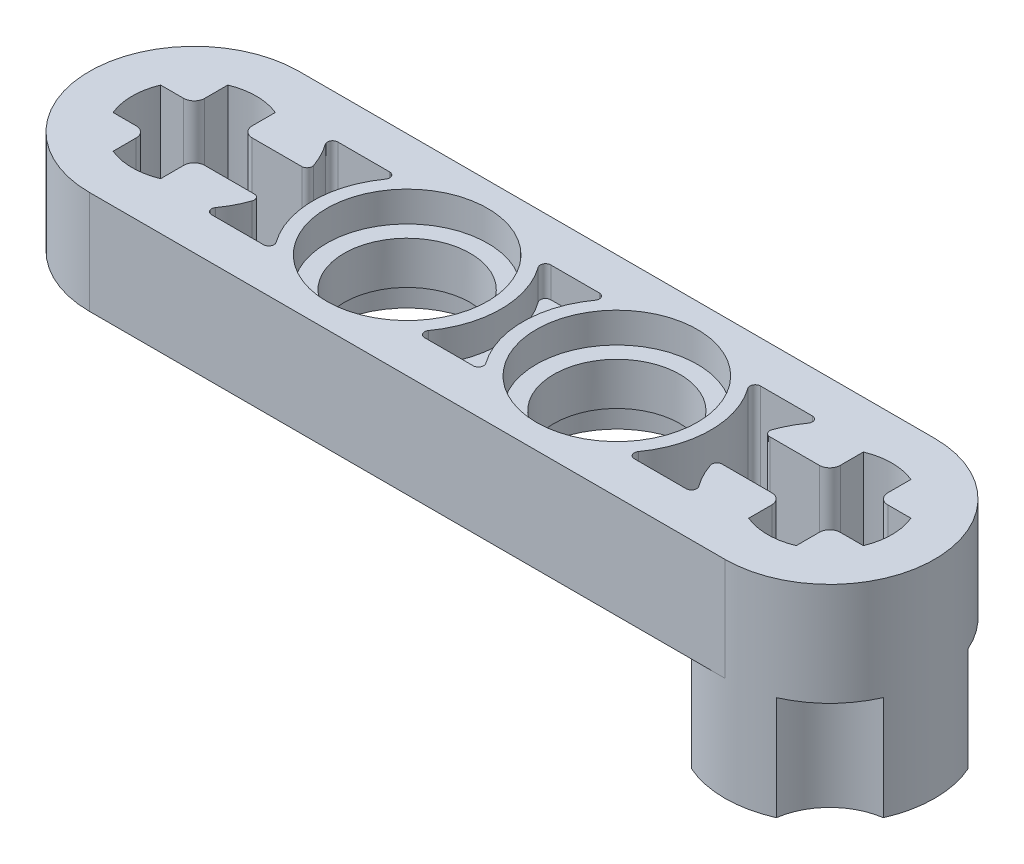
SolidWorks part; units mm, degrees
ref_plane "Front" through (0, 0, 0) normal (0, 0, 1) x (1, 0, 0)
ref_plane "Top" through (0, 0, 0) normal (0, 1, 0) x (1, 0, 0)
ref_plane "Right" through (0, 0, 0) normal (1, 0, 0) x (0, 0, -1)
sketch "Sketch1" plane through (0, 0, 0) normal (0, 1, 0) x (1, 0, 0)
  line L0 (0, 0) -> (0, 8.6394) construction
  line L1 (-12.0312, 3.9687) -> (12.0312, 3.9687)
  line L2 (12.0312, -3.9688) -> (-12.0312, -3.9688)
  line L3 (0, 0) -> (18.7139, 0) construction
  arc A0 (12.0312, 3.9687) -> (12.0312, -3.9688) centre (12.0312, 0) cw
  arc A1 (-12.0312, 3.9687) -> (-12.0312, -3.9688) centre (-12.0312, 0) ccw
  point P6 (0, 3.9687)
  point P11 (0, -3.9688)
  dimension "D1" = 7.9375
  dimension "D2" = 32
extrude "Base-Extrude" add sketch "Sketch1" along normal mid plane 3.9
sketch "Sketch2" plane through (0, 1.95, 0) normal (0, 1, 0) x (-1, 0, 0)
  circle A0 centre (3.9688, 0) radius 2.3876
  dimension "D1" = 4.7752
  dimension "D2" = 3.9688
extrude "Cut-Extrude1" cut sketch "Sketch2" against normal through all
sketch "Sketch3" plane through (0, 1.95, 0) normal (0, 1, 0) x (-1, 0, 0)
  circle A0 centre (3.9688, 0) radius 3.048
  dimension "D1" = 6.096
extrude "Cut-Extrude2" cut sketch "Sketch3" against normal blind 1.143
sketch "Sketch4" plane through (0, -1.95, 0) normal (0, -1, 0) x (1, 0, 0)
  circle A0 centre (-3.9688, 0) radius 3.048
  dimension "D1" = 6.096
extrude "Cut-Extrude3" cut sketch "Sketch4" against normal blind 1.143
pattern_linear "LPattern1" count 2 spacing 7.9375 along (1, 0, 0) of "Cut-Extrude3", "Cut-Extrude2", "Cut-Extrude1"
sketch "Sketch5" plane through (0, 1.95, 0) normal (0, 1, 0) x (-1, 0, 0)
  line L0 (12.0312, 0) -> (12.0312, -5.3472) construction
  line L1 (12.0312, 0) -> (8.2567, 0) construction
  line L2 (11.1312, -2.1708) -> (11.1312, -0.9)
  line L3 (11.1312, -0.9) -> (9.8604, -0.9)
  line L4 (11.1312, 0.9) -> (9.8604, 0.9)
  line L5 (11.1312, 2.1708) -> (11.1312, 0.9)
  line L6 (12.9313, 2.1708) -> (12.9313, 0.9)
  line L7 (12.9313, 0.9) -> (14.2021, 0.9)
  line L8 (12.9313, -0.9) -> (14.2021, -0.9)
  line L9 (12.9313, -2.1708) -> (12.9313, -0.9)
  arc A0 (11.1312, -2.1708) -> (12.9313, -2.1708) centre (12.0312, 0) ccw
  arc A1 (9.8604, 0.9) -> (9.8604, -0.9) centre (12.0312, 0) ccw
  arc A2 (12.9313, 2.1708) -> (11.1312, 2.1708) centre (12.0312, 0) ccw
  arc A3 (14.2021, -0.9) -> (14.2021, 0.9) centre (12.0312, 0) ccw
  dimension "D1" = 4.7
  dimension "D2" = 0.9
extrude "Cut-Extrude4" cut sketch "Sketch5" against normal through all
fillet "Fillet1" radius 0.3969 4 edges at (-12.9313, 0, -0.9) (-11.1312, 0, -0.9) (-12.9313, 0, 0.9) (-11.1312, 0, 0.9)
sketch "Sketch6" plane through (0, 1.95, 0) normal (0, 1, 0) x (-1, 0, 0)
  line L0 (9.396, -2.3876) -> (6.604, -2.3876)
  line L1 (12.0312, 0) -> (3.9688, 0) construction
  line L2 (9.396, 2.3876) -> (6.604, 2.3876)
  line L3 (9.8604, -0.9) -> (8.591, -0.9)
  line L4 (9.8604, 0.9) -> (8.591, 0.9)
  circle A0 centre (3.9688, 0) radius 2.3876 construction
  arc A2 (6.604, -2.3876) -> (6.604, 2.3876) centre (3.9688, 0) ccw
  arc A3 (9.396, 2.3876) -> (8.591, 0.9) centre (12.0312, 0) ccw
  arc A4 (9.8604, 0.9) -> (9.8604, -0.9) centre (12.0312, 0) ccw construction
  arc A5 (9.8604, 0.9) -> (9.8604, -0.9) centre (12.0312, 0) ccw
  arc A6 (8.591, -0.9) -> (9.396, -2.3876) centre (12.0312, 0) ccw
  dimension "D2" = 7.112
extrude "Cut-Extrude5" cut sketch "Sketch6" against normal through all
fillet "Fillet2" radius 0.1984 6 edges at (-8.591, 0, -0.9) (-9.396, 0, -2.3876) (-6.604, 0, -2.3876) (-6.604, 0, 2.3876) (-9.396, 0, 2.3876) (-8.591, 0, 0.9)
mirror "Mirror1" about plane through (0, 0, 0) normal (1, 0, 0) of "Fillet2", "Cut-Extrude5", "Fillet1", "Cut-Extrude4"
sketch "Sketch7" plane through (7.6266, 1.95, -1.7506) normal (0, 1, 0) x (-1, 0, 0)
  line L0 (8.9601, -0.637) -> (6.2931, -0.637)
  line L1 (11.5954, 1.7506) -> (3.6579, 1.7506) construction
  line L2 (8.9601, 4.1382) -> (6.2931, 4.1382)
  circle A0 centre (11.5954, 1.7506) radius 2.3876 construction
  circle A1 centre (3.6579, 1.7506) radius 2.3876 construction
  arc A2 (6.2931, -0.637) -> (6.2931, 4.1382) centre (3.6579, 1.7506) ccw
  arc A3 (8.9601, 4.1382) -> (8.0394, 1.7506) centre (11.5954, 1.7506) ccw
  arc A6 (8.0394, 1.7506) -> (8.9601, -0.637) centre (11.5954, 1.7506) ccw
  dimension "D2" = 7.112
extrude "Cut-Extrude6" cut sketch "Sketch7" against normal blind 1.143
fillet "Fillet3" radius 0.1984 4 edges at (-1.3335, 1.3785, -2.3876) (1.3335, 1.3785, -2.3876) (1.3335, 1.3785, 2.3876) (-1.3335, 1.3785, 2.3876)
mirror "Mirror2" about plane through (0, 0, 0) normal (0, 1, 0) of "Fillet3", "Cut-Extrude6"
sketch "Sketch8" plane through (0, -1.95, 0) normal (0, -1, 0) x (1, 0, 0)
  circle A0 centre (12.0312, 0) radius 3.9687
  circle A1 centre (12.0312, 0) radius 2.3876
extrude "Boss-Extrude1" add sketch "Sketch8" along normal blind 3.937
sketch "Sketch9" plane through (0, -5.887, 0) normal (0, -1, 0) x (1, 0, 0)
  line L0 (12.0312, 0) -> (12.0312, -4.7829) construction
  line L1 (12.0312, 0) -> (15.9049, -3.8736) construction
  circle A0 centre (16, -3.9687) radius 2.3876
  dimension "D2" = 4.7752
  dimension "D1" = 45
  dimension "D3" = 3.9688
extrude "Cut-Extrude7" cut sketch "Sketch9" against normal up to surface (3.937 mm away)
pattern_circular "CirPattern1" count 4 every 90 about axis through (12.0312, 0, 0) along (0, 1, 0) of "Cut-Extrude7"
